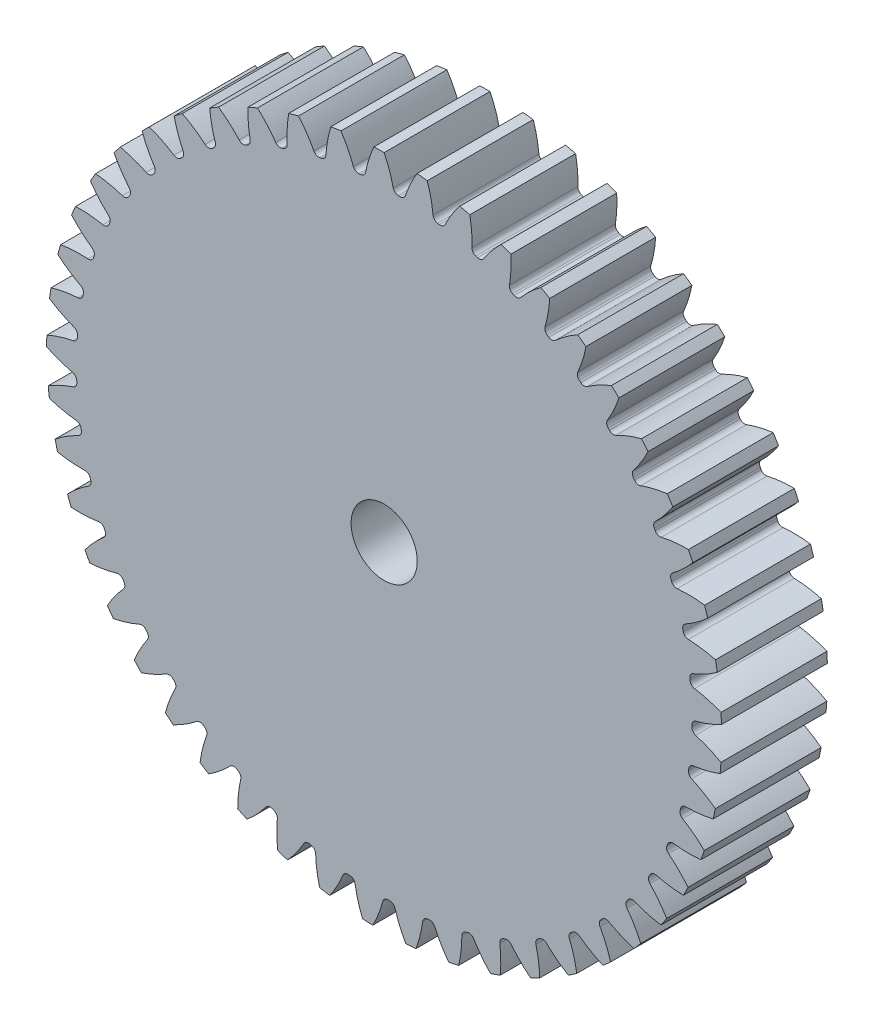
SolidWorks part; units mm, degrees
ref_plane "Front" through (0, 0, 0) normal (0, 0, 1) x (1, 0, 0)
ref_plane "Top" through (0, 0, 0) normal (0, 1, 0) x (1, 0, 0)
ref_plane "Right" through (0, 0, 0) normal (1, 0, 0) x (0, 0, -1)
sketch "Sketch3" plane through (0, 0, 0) normal (0, 0, 1) x (1, 0, 0)
  circle A0 centre (0, 0) radius 323.85
  dimension "od" = 647.7
extrude "gearBody" add sketch "Sketch3" along normal blind 101.6
sketch "Sketch2" plane through (0, 0, 0) normal (0, 0, 1) x (1, 0, 0)
  line L0 (0, 0) -> (270.1288, 111.891) construction
  line L1 (323.3134, -21.3784) -> (0, 0) construction
  line L2 (0, 0) -> (36.3143, 0) construction
  line L3 (311.1146, 4.6962) -> (310.7799, -15.1709) construction
  line L5 (310.9472, -5.2374) -> (0, 0) construction
  line L7 (0, 0) -> (292.3854, 0) construction
  arc A0 (292.3845, -0.6933) -> (292.242, -9.1537) centre (0, 0) ccw construction
  arc A1 (323.6833, 10.3899) -> (323.1498, -21.2847) centre (0, 0) ccw construction
  arc A2 (311.1146, 4.6962) -> (310.7799, -15.1709) centre (0, 0) ccw construction
  arc A3 (295.2168, -5.863) -> (295.2468, -4.0823) centre (0, 0) ccw
  arc A4 (323.3134, -21.3784) -> (298.9117, -10.9202) centre (266.2075, -120.9247) ccw
  arc A5 (323.3134, -21.3784) -> (323.85, 10.4781) centre (0, 0) ccw
  arc A6 (323.85, 10.4781) -> (299.1099, 0.8476) centre (270.1288, 111.891) cw
  arc A7 (295.2468, -4.0823) -> (299.1099, 0.8476) centre (300.4152, -4.1538) cw
  arc A8 (298.9117, -10.9202) -> (295.2168, -5.863) centre (300.3847, -5.9656) cw
  point P6 (323.85, 10.4781)
  point P22 (323.3134, -21.3784)
  dimension "baseDia" = 584.7707
  dimension "od" = 647.7
  dimension "pd" = 622.3
  dimension "rd" = 590.55
  dimension "rFillet" = 5.1689
  dimension "pointX" = 323.85
  dimension "pointY" = 10.4781
  dimension "CTT" = 19.8672
  dimension "flankCenterAngle" = 22.5
extrude "toothCut" cut sketch "Sketch2" along normal through all
pattern_circular "CirPattern1" count 49 over 360 about axis through (0, 0, 0) along (0, 0, 1) of "toothCut"
sketch "hub1Dia" plane through (0, 0, 0) normal (0, 0, -1) x (-1, 0, 0)
  circle A0 centre (0, 0) radius 12.7
  dimension "hub1Dia" = 25.4
sketch "hub2Dia" plane through (0, 0, 101.6) normal (0, 0, 1) x (1, 0, 0)
  circle A0 centre (0, 0) radius 12.7
  dimension "hub2dia" = 25.4
sketch "boreDia" plane through (0, 0, 0) normal (0, 0, 1) x (1, 0, 0)
  circle A0 centre (0, 0) radius 31.75
  dimension "boreDia" = 63.5
extrude "bore" cut sketch "boreDia" against normal mid plane 25400
